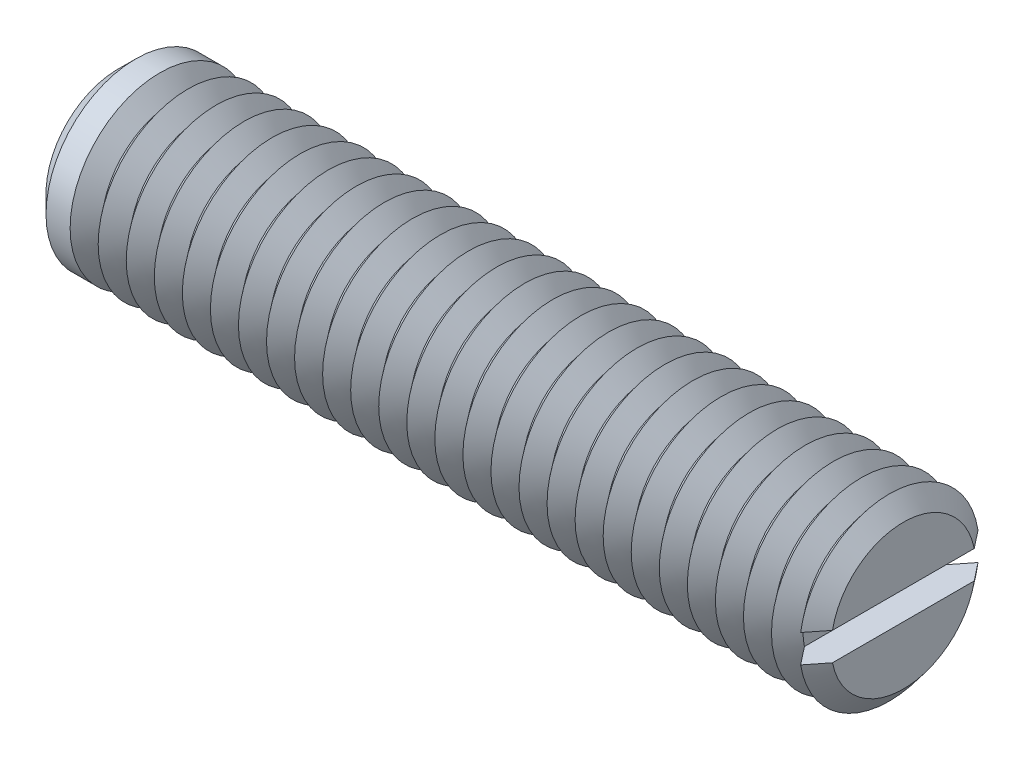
SolidWorks part; units mm, degrees
ref_plane "Front Plane" through (0, 0, 0) normal (0, 0, 1) x (1, 0, 0)
ref_plane "Top Plane" through (0, 0, 0) normal (0, 1, 0) x (1, 0, 0)
ref_plane "Right Plane" through (0, 0, 0) normal (1, 0, 0) x (0, 0, -1)
sketch "Sketch1" plane through (0, 0, 0) normal (1, 0, 0) x (0, 0, -1)
  circle A0 centre (0, 0) radius 4
  dimension "D1" = 8
extrude "Extrude1" add sketch "Sketch1" along normal mid plane 35
sketch "Sketch2" plane through (0, 0, 0) normal (0, 0, 1) x (1, 0, 0)
  line L0 (17.5, 0.625) -> (16.25, 0.625)
  line L1 (17.5, -4) -> (17.5, 4) construction
  line L2 (16.25, 0.625) -> (16.25, -0.625)
  line L3 (0, 0) -> (50000, 0) construction
  line L4 (17.5, -0.625) -> (16.25, -0.625)
  line L5 (17.5, -0.625) -> (17.5, 0.625)
  point P9 (16.25, 0)
  dimension "D1" = 1.25
extrude "Extrude2" cut sketch "Sketch2" against normal mid plane 12
chamfer "Chamfer1" distance 0.8 angle 45 1 edges at (-17.5, 0, -4)
sketch "Sketch3" plane through (0, 0, 0) normal (0, 0, 1) x (1, 0, 0)
  line L0 (0, 0) -> (30.9602, 0) construction
  line L1 (16.875, -4) -> (18.125, -4)
  line L2 (-16.7, -4) -> (17.5, -4) construction
  line L3 (18.125, -4) -> (17.5, -3.2194)
  line L4 (17.5, -4) -> (17.5, -0.625) construction
  line L5 (17.5, -3.2194) -> (16.875, -4)
  dimension "D1" = 1.25
  dimension "D2" = 1
revolve "Cut-Revolve1" cut sketch "Sketch3" angle 360 about L0
pattern_linear "LPattern1" count 27 spacing 1.25 along (-1, 0, 0) of "Cut-Revolve1"
equation "\"D2@Sketch3\" = \"D1@Sketch3\"*0.8"
